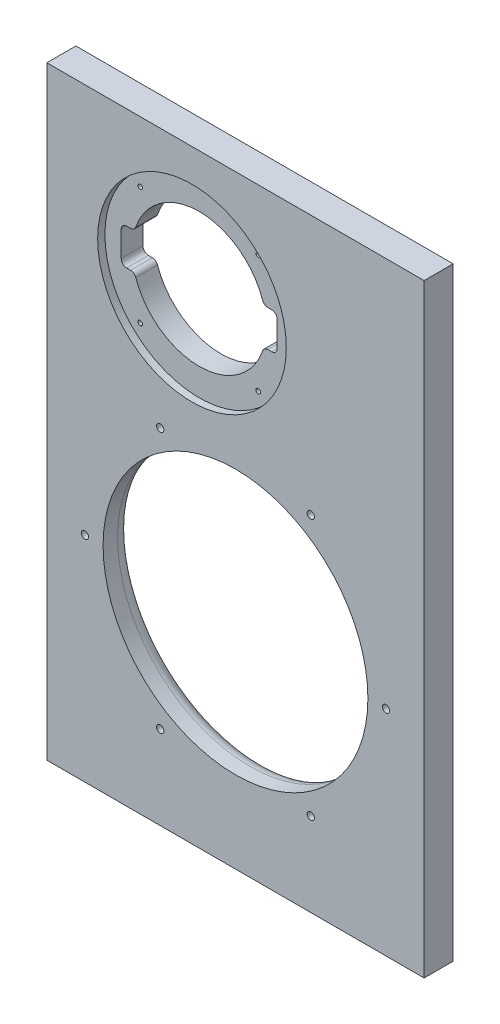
SolidWorks part; units mm, degrees
ref_plane "Спереди" through (0, 0, 0) normal (0, 0, 1) x (1, 0, 0)
ref_plane "Сверху" through (0, 0, 0) normal (0, 1, 0) x (1, 0, 0)
ref_plane "Справа" through (0, 0, 0) normal (1, 0, 0) x (0, 0, -1)
sketch "Эскиз1" plane through (0, 0, 0) normal (0, 0, 1) x (1, 0, 0)
  line L0 (0, -10) -> (208, -10)
  line L1 (0, -343) -> (208, -343)
  line L2 (0, -10) -> (0, -343)
  line L4 (208, -10) -> (208, -343)
extrude "Вытянуть1" add sketch "Эскиз1" along normal blind 16
sketch "Эскиз2" plane through (0, 0, 16) normal (0, 0, 1) x (1, 0, 0)
  line L0 (104, -359.0489) -> (104, 19.2273) construction
  line L9 (123, -72.9973) -> (123, -86.9973)
  line L10 (37, -72.9973) -> (37, -86.9973)
  line L11 (117.8286, -89.9973) -> (120, -89.9973)
  line L12 (40, -89.9973) -> (42.1714, -89.9973)
  line L13 (117.8286, -69.9973) -> (120, -69.9973)
  line L14 (40, -69.9973) -> (42.1714, -69.9973)
  circle A0 centre (104, -224.9973) radius 73
  circle A1 centre (80, -79.9973) radius 52 construction
  circle A2 centre (104, -224.9973) radius 88 construction
  arc A11 (37, -86.9973) -> (40, -89.9973) centre (40, -86.9973) ccw
  arc A12 (123, -72.9973) -> (120, -69.9973) centre (120, -72.9973) ccw
  arc A13 (114.9914, -92.0223) -> (117.8286, -89.9973) centre (117.8286, -92.9973) cw
  arc A14 (114.9914, -67.9723) -> (45.0086, -67.9723) centre (80, -79.9973) ccw
  arc A15 (123, -86.9973) -> (120, -89.9973) centre (120, -86.9973) cw
  arc A16 (42.1714, -69.9973) -> (45.0086, -67.9723) centre (42.1714, -66.9973) ccw
  arc A17 (37, -72.9973) -> (40, -69.9973) centre (40, -72.9973) cw
  arc A18 (114.9914, -67.9723) -> (117.8286, -69.9973) centre (117.8286, -66.9973) ccw
  arc A19 (42.1714, -89.9973) -> (45.0086, -92.0223) centre (42.1714, -92.9973) cw
  arc A20 (45.0086, -92.0223) -> (114.9914, -92.0223) centre (80, -79.9973) ccw
  point P57 (44.377, -89.9973)
  point P60 (115.623, -69.9973)
  point P63 (115.623, -89.9973)
  dimension "D1" = 146
  dimension "D2" = 145
  dimension "D3" = 104
  dimension "D4" = 176
  dimension "D5" = 24
extrude "Вырез-Вытянуть1" cut sketch "Эскиз2" against normal through all
sketch "Эскиз3" plane through (0, 0, 16) normal (0, 0, 1) x (1, 0, 0)
  line L0 (80, -42.9973) -> (80, -116.9973) construction
  arc A0 (114.9914, -67.9723) -> (45.0086, -67.9723) centre (80, -79.9973) ccw construction
  arc A1 (45.0086, -92.0223) -> (114.9914, -92.0223) centre (80, -79.9973) ccw construction
  circle A2 centre (80, -79.9973) radius 52
  dimension "D1" = 104
extrude "Вырез-Вытянуть2" cut sketch "Эскиз3" against normal blind 4
sketch "Эскиз7" plane through (0, 0, 16) normal (0, 0, 1) x (1, 0, 0)
  circle A0 centre (62.5, -153.1172) radius 2
  circle A1 centre (145.5, -153.1172) radius 2
  circle A2 centre (187, -224.9973) radius 2
  circle A3 centre (145.5, -296.8774) radius 2
  circle A4 centre (62.5, -296.8774) radius 2
  circle A5 centre (21, -224.9973) radius 2
  circle A6 centre (112.5269, -47.4704) radius 1.25
  circle A7 centre (112.5269, -112.5242) radius 1.25
  circle A8 centre (47.4731, -112.5242) radius 1.25
  circle A9 centre (47.4731, -47.4704) radius 1.25
  point P0 (104, -224.9973)
  dimension "D1" = 6
  dimension "D2" = 166
  dimension "D3" = 4
extrude "Вырез-Вытянуть3" cut sketch "Эскиз7" against normal blind 16
fillet "Скругление1" radius 8 1 edges at (177, -224.9973, 0)
